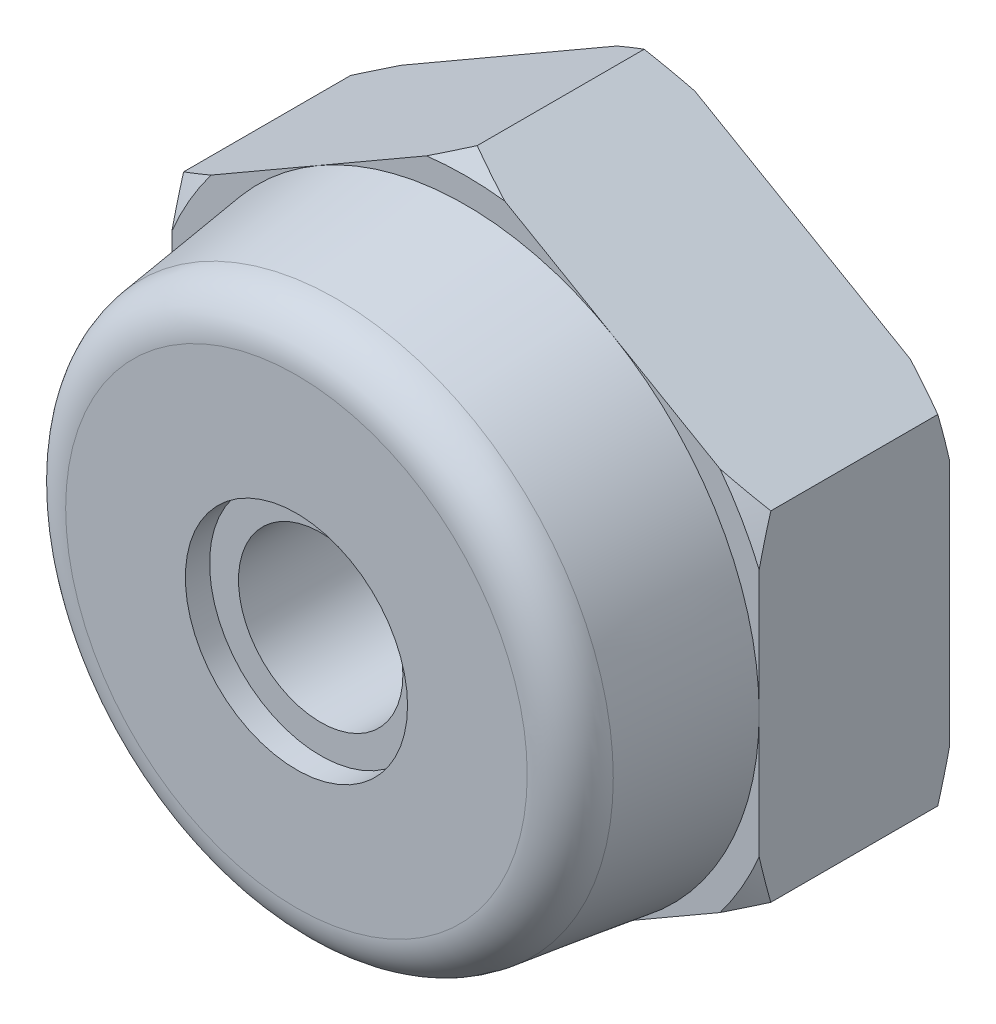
SolidWorks part; units mm, degrees
ref_plane "Front" through (0, 0, 0) normal (0, 0, 1) x (1, 0, 0)
ref_plane "Top" through (0, 0, 0) normal (0, 1, 0) x (1, 0, 0)
ref_plane "Right" through (0, 0, 0) normal (1, 0, 0) x (0, 0, -1)
sketch "BaseNutSke" plane through (0, 0, 0) normal (0, 0, 1) x (1, 0, 0)
  line L1 (3.175, -1.8331) -> (3.175, 1.8331)
  line L2 (3.175, 1.8331) -> (0, 3.6662)
  line L3 (0, 3.6662) -> (-3.175, 1.8331)
  line L4 (-3.175, 1.8331) -> (-3.175, -1.8331)
  line L5 (-3.175, -1.8331) -> (0, -3.6662)
  line L12 (0, -3.6662) -> (3.175, -1.8331)
  circle A0 centre (0, 0) radius 0.889
  circle A2 centre (0, 0) radius 3.175 construction
  dimension "Tap_Drill" = 1.778
  dimension "A" = 6.35
extrude "BaseNut" add sketch "BaseNutSke" against normal blind 2.0574
sketch "TorqEleSke" plane through (0, 0, 0) normal (0, 1, 0) x (0, 0, -1)
  line L0 (-9.4809, 0) -> (15.875, 0) construction
  line L1 (0, 0) -> (0, 3.175) construction
  line L2 (-1.5667, 1.2014) -> (-1.5667, 0.889)
  line L3 (0, 0.889) -> (0, 3.175)
  line L4 (0, 3.175) -> (-1.3941, 2.9915)
  line L5 (-1.5667, 0.889) -> (0, 0.889)
  line L6 (-1.5667, 1.2014) -> (-1.8288, 1.2014)
  line L7 (-1.8288, 1.2014) -> (-1.8288, 2.4957)
  line L10 (0, -3.175) -> (0, 0) construction
  line L11 (2.0574, -3.175) -> (2.0574, 0) construction
  arc A0 (-1.8288, 2.4957) -> (-1.3941, 2.9915) centre (-1.3288, 2.4957) cw
revolve "TorqueElement" add sketch "TorqEleSke" angle 360 about L0
sketch "Sketch3" plane through (0, 0, 0) normal (1, 0, 0) x (0, 0, -1)
  line L0 (2.0574, 3.4477) -> (1.9313, 3.6662)
  line L1 (0, 3.6662) -> (0, 3.4477)
  line L2 (1.9313, 3.6662) -> (2.0574, 3.6662)
  line L3 (2.0574, 3.6662) -> (2.0574, 3.4477)
  line L4 (0.1261, 3.6662) -> (0, 3.6662)
  line L5 (0, 3.4477) -> (0.1261, 3.6662)
  line L7 (0, 0) -> (38.6776, 0) construction
  line L9 (1.0287, 4.0415) -> (1.0287, 50004.0415) construction
  line L15 (2.0574, 3.6662) -> (0, 3.6662) construction
  point P23 (1.0287, 3.6662)
revolve "DoubleChamfer" cut sketch "Sketch3" angle 360 about L7
sketch "ThdSchSke" plane through (0, 0, 0) normal (0, 1, 0) x (1, 0, 0)
  line L0 (-1.0922, 2.0574) -> (-0.889, 2.1747)
  line L1 (-3.175, 2.0574) -> (-50003.175, 2.0574) construction
  line L2 (-0.889, 2.1747) -> (-0.889, 1.9401)
  line L3 (0.889, 2.0574) -> (-0.889, 2.0574) construction
  line L4 (-0.889, 1.9401) -> (-1.0922, 2.0574)
  line L6 (0, -1.4815) -> (0, -2.9874) construction
  line L7 (-0.889, 2.0574) -> (-0.889, -1.5667) construction
revolve "ThreadSchematic" cut sketch "ThdSchSke" angle 360 about L6
pattern_linear "ThdSchPat" [suppressed]
equation "\"Inset_Dia@TorqEleSke\" = \"ThreadSize@ThdSchSke\" * 1.1"
equation "\"D3@TorqEleSke\" = \"ThreadSize@ThdSchSke\" * .12"
equation "\"ChamferLen@Sketch3\"=\"ThreadSize@ThdSchSke\"*.1"
